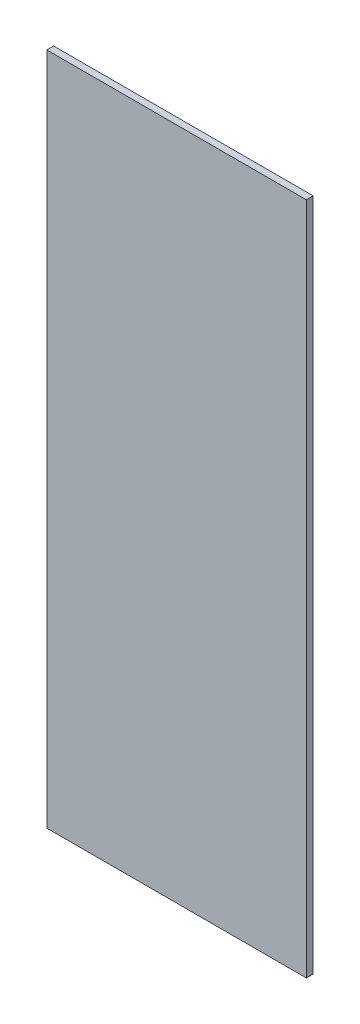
SolidWorks part; units mm, degrees
ref_plane "Alzado" through (0, 0, 0) normal (0, 0, 1) x (1, 0, 0)
ref_plane "Planta" through (0, 0, 0) normal (0, 1, 0) x (1, 0, 0)
ref_plane "Vista lateral" through (0, 0, 0) normal (1, 0, 0) x (0, 0, -1)
sketch "Croquis1" plane through (0, 0, 0) normal (0, 0, 1) x (1, 0, 0)
  line L1 (285, -740) -> (-285, -740)
  line L2 (285, -740) -> (285, 740)
  line L3 (285, 740) -> (-285, 740)
  line L4 (-285, -740) -> (-285, 740)
  line L5 (285, -740) -> (-285, 740) construction
  line L6 (285, 740) -> (-285, -740) construction
  point P0 (0, 0)
  dimension "D1" = 570
  dimension "D2" = 1480
extrude "Saliente-Extruir1" add sketch "Croquis1" along normal blind 15
